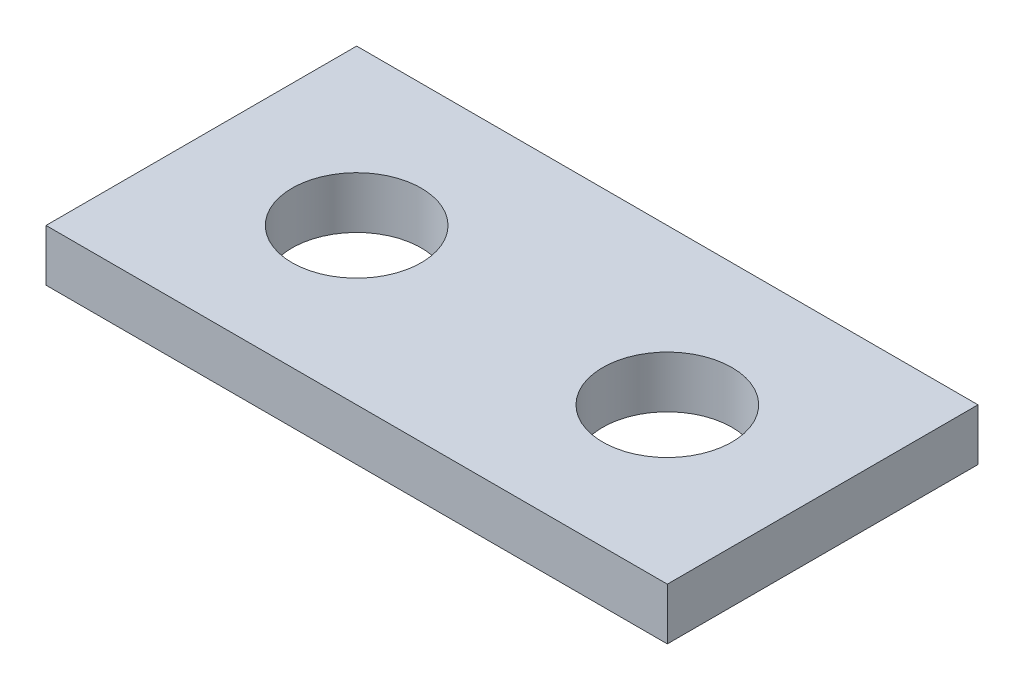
SolidWorks part; units mm, degrees
ref_plane "Front Plane" through (0, 0, 0) normal (0, 0, 1) x (1, 0, 0)
ref_plane "Top Plane" through (0, 0, 0) normal (0, 1, 0) x (1, 0, 0)
ref_plane "Right Plane" through (0, 0, 0) normal (1, 0, 0) x (0, 0, -1)
sketch "Sketch1" plane through (0, 0, 0) normal (0, 1, 0) x (1, 0, 0)
  line L0 (0, 0) -> (0, 14.9391) construction
  line L1 (-9.525, -4.7625) -> (9.525, -4.7625)
  line L2 (-9.525, -4.7625) -> (-9.525, 4.7625)
  line L3 (-9.525, 4.7625) -> (9.525, 4.7625)
  line L4 (9.525, -4.7625) -> (9.525, 4.7625)
  line L5 (-9.525, -4.7625) -> (9.525, 4.7625) construction
  line L6 (-9.525, 4.7625) -> (9.525, -4.7625) construction
  line L7 (0, 0) -> (-34.5199, 0) construction
  circle A0 centre (-4.7625, 0) radius 1.9812
  circle A1 centre (4.7625, 0) radius 1.9812
  point P0 (0, 0)
  dimension "D3" = 3.9624
  dimension "D4" = 9.525
  dimension "D1" = 9.525
  dimension "D2" = 19.05
extrude "Boss-Extrude1" add sketch "Sketch1" along normal blind 1.5875
